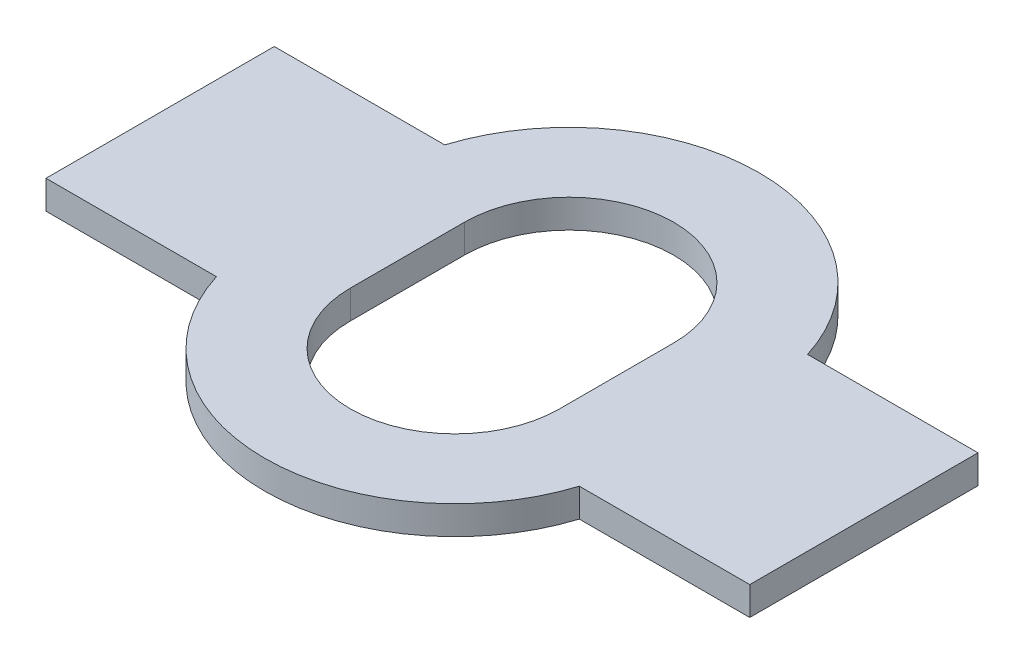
SolidWorks part; units mm, degrees
ref_plane "Front Plane" through (0, 0, 0) normal (0, 0, 1) x (1, 0, 0)
ref_plane "Top Plane" through (0, 0, 0) normal (0, 1, 0) x (1, 0, 0)
ref_plane "Right Plane" through (0, 0, 0) normal (1, 0, 0) x (0, 0, -1)
sketch "Sketch1" plane through (0, 0, 0) normal (0, 1, 0) x (1, 0, 0)
  line L0 (37, 12) -> (19.0788, 12)
  line L1 (-19.0788, 12) -> (-37, 12)
  line L2 (-37, -12) -> (-37, 12)
  line L4 (37, -12) -> (37, 12)
  line L5 (-37, -12) -> (-19.0788, -12)
  line L6 (37, 0) -> (-37, 0) construction
  line L7 (0, 30) -> (0, -30) construction
  line L8 (11, 6) -> (11, -6)
  line L9 (-11, 6) -> (-11, -6)
  line L10 (19.0788, -12) -> (37, -12)
  arc A0 (11, 6) -> (-11, 6) centre (0, 6) ccw
  arc A1 (-11, -6) -> (11, -6) centre (0, -6) ccw
  arc A2 (19.0788, 12) -> (-19.0788, 12) centre (0, 6) ccw
  arc A3 (-19.0788, -12) -> (19.0788, -12) centre (0, -6) ccw
  dimension "D3" = 12
  dimension "D4" = 20
  dimension "D5" = 6
  dimension "D7" = 11
  dimension "D8" = 11
  dimension "D9" = 20
  dimension "D1" = 37
  dimension "D2" = 37
  dimension "D6" = 6
extrude "Extrude1" add sketch "Sketch1" along normal blind 3
